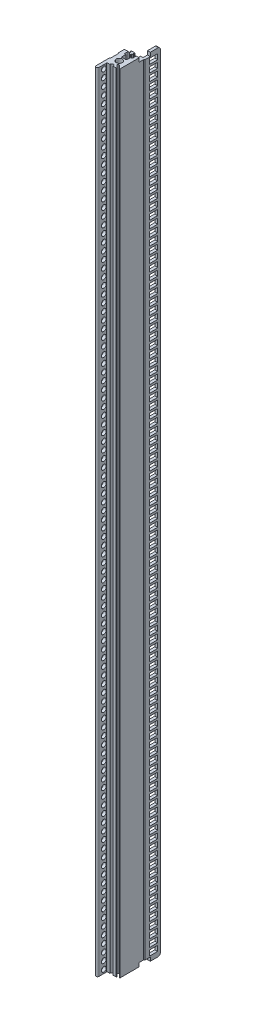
SolidWorks part; units mm, degrees
ref_plane "前视基准面" through (0, 0, 0) normal (0, 0, 1) x (1, 0, 0)
ref_plane "上视基准面" through (0, 0, 0) normal (0, 1, 0) x (1, 0, 0)
ref_plane "右视基准面" through (0, 0, 0) normal (1, 0, 0) x (0, 0, -1)
sketch "草图1" plane through (0, 0, 0) normal (0, 1, 0) x (1, 0, 0)
  line L0 (-4.2, 11.9) -> (-3.9, 11.9)
  line L1 (-4.4, 12.2) -> (-4.4, 12.1)
  line L2 (-4.0328, 12.4) -> (-4.2, 12.4)
  line L3 (-3.85, 12.5) -> (-3.8914, 12.4586)
  line L4 (-2.05, 12.5) -> (-3.85, 12.5)
  line L5 (-2.0086, 12.4586) -> (-2.05, 12.5)
  line L6 (-1.7, 12.4) -> (-1.8672, 12.4)
  line L7 (-1.5, 12.1) -> (-1.5, 12.2)
  line L8 (-1.8, 11.9) -> (-1.7, 11.9)
  line L9 (-2, 11.4828) -> (-2, 11.7)
  line L10 (-1.3586, 10.7586) -> (-1.9414, 11.3414)
  line L11 (-1.3, 10.55) -> (-1.3, 10.6172)
  line L12 (-3.7, 11.7) -> (-3.7, 9.95)
  line L13 (-5, -10.75) -> (-5, -1.6)
  line L14 (-3, -10.75) -> (-3, -5.75)
  line L15 (-2.5, -5.25) -> (-1.15, -5.25)
  line L16 (1.6887, -3.3855) -> (3.2118, -4.9086)
  line L17 (2.5373, -2.537) -> (4.6586, -4.6583)
  line L18 (5, 15) -> (5, 5.1793)
  line L19 (3.6, 15) -> (5, 15)
  line L20 (3.6, 12.5) -> (3.6, 15)
  line L21 (1.95, 12.5) -> (3.6, 12.5)
  line L22 (1.95, 10.55) -> (1.95, 12.5)
  line L23 (2.85, 10.55) -> (1.95, 10.55)
  line L24 (2.85, 9.35) -> (2.85, 10.55)
  line L25 (1.95, 9.35) -> (2.85, 9.35)
  line L26 (1.95, 8.35) -> (1.95, 9.35)
  line L27 (2.85, 8.35) -> (1.95, 8.35)
  line L28 (2.85, 6.05) -> (2.85, 8.35)
  line L29 (1.95, 6.05) -> (2.85, 6.05)
  line L30 (1.95, 3.8856) -> (1.95, 6.05)
  line L31 (-1.45, 6.05) -> (-1.45, 2.9458)
  line L32 (-2.35, 6.05) -> (-1.45, 6.05)
  line L33 (-2.35, 8.35) -> (-2.35, 6.05)
  line L34 (-1.45, 8.35) -> (-2.35, 8.35)
  line L35 (-1.45, 9.35) -> (-1.45, 8.35)
  line L36 (-2.35, 9.35) -> (-1.45, 9.35)
  line L37 (-2.35, 10.55) -> (-2.35, 9.35)
  line L38 (-1.3, 10.55) -> (-2.35, 10.55)
  line L39 (-4.45, 7.7) -> (-4.7, 7.7) construction
  line L40 (-5, 7.4) -> (-4.7, 7.7) construction
  line L41 (-5, 4.4) -> (-5, 7.4)
  line L42 (-4.5499, 3.8998) -> (-5, 4.4)
  line L43 (-4.45, 8.5) -> (-4.45, 9.55)
  line L44 (-3.9, 9.75) -> (-4.25, 9.75)
  line L45 (-4.5499, 3.8998) -> (-4.5501, -1.1002)
  line L46 (-5, -1.6) -> (-4.5501, -1.1002)
  line L47 (4.9414, -1.9395) -> (4.6464, -1.6446) construction
  line L48 (5, -2.081) -> (5, -4.5169)
  line L49 (0, 0) -> (0, -5) construction
  line L50 (4.5, -1.291) -> (4.5, 4.3894) construction
  line L51 (-1.05, -5) -> (-1.05, -5.15)
  line L52 (1.05, -5) -> (1.05, -5.15)
  line L53 (1.15, -5.25) -> (3.0703, -5.25)
  line L54 (2.5373, -2.537) -> (1.6887, -3.3855) construction
  line L55 (5, 5.1793) -> (5, -2.081)
  line L56 (-4.45, 8.5) -> (-4.7, 8.5)
  line L57 (-4.7, 8.5) -> (-5, 8.2)
  line L58 (4.9414, 5.0379) -> (4.6464, 4.743) construction
  line L59 (-5, 8.2) -> (-5, 7.4)
  circle A0 centre (0, 0) radius 1.6
  arc A1 (-4.4, 12.1) -> (-4.2, 11.9) centre (-4.2, 12.1) ccw
  arc A2 (-4.2, 12.4) -> (-4.4, 12.2) centre (-4.2, 12.2) ccw
  arc A3 (-4.0328, 12.4) -> (-3.8914, 12.4586) centre (-4.0328, 12.6) ccw
  arc A4 (-2.0086, 12.4586) -> (-1.8672, 12.4) centre (-1.8672, 12.6) ccw
  arc A5 (-1.5, 12.2) -> (-1.7, 12.4) centre (-1.7, 12.2) ccw
  arc A6 (-1.7, 11.9) -> (-1.5, 12.1) centre (-1.7, 12.1) ccw
  arc A7 (-1.8, 11.9) -> (-2, 11.7) centre (-1.8, 11.7) ccw
  arc A8 (-2, 11.4828) -> (-1.9414, 11.3414) centre (-1.8, 11.4828) ccw
  arc A9 (-1.3, 10.6172) -> (-1.3586, 10.7586) centre (-1.5, 10.6172) ccw
  arc A10 (-5, -10.75) -> (-3, -10.75) centre (-4, -10.75) ccw
  arc A11 (3.0703, -5.25) -> (3.2118, -4.9086) centre (3.0703, -5.05) ccw
  arc A12 (-4.25, 9.75) -> (-4.45, 9.55) centre (-4.25, 9.55) ccw
  arc A13 (-3.9, 9.75) -> (-3.7, 9.95) centre (-3.9, 9.95) ccw
  arc A14 (5, -2.081) -> (4.9414, -1.9395) centre (4.8, -2.081) ccw construction
  arc A15 (4.9414, 5.0379) -> (5, 5.1793) centre (4.8, 5.1793) ccw construction
  arc A16 (4.6586, -4.6583) -> (5, -4.5169) centre (4.8, -4.5169) ccw
  arc A17 (2.5373, -2.537) -> (1.6887, -3.3855) centre (2.113, -2.9613) ccw
  arc A18 (0.7125, 2.9142) -> (-1.1719, 2.7616) centre (0, 0) ccw
  arc A19 (-1.45, 2.9458) -> (-1.1719, 2.7616) centre (-1.25, 2.9458) ccw
  arc A20 (0.7125, 2.9142) -> (1.95, 3.8856) centre (0.95, 3.8856) ccw
  arc A21 (-3.7, 11.7) -> (-3.9, 11.9) centre (-3.9, 11.7) ccw
  arc A22 (4.6464, -1.6446) -> (4.5, -1.291) centre (5, -1.291) cw construction
  arc A23 (4.5, 4.3894) -> (4.6464, 4.743) centre (5, 4.3894) cw construction
  arc A24 (1.05, -5) -> (-1.05, -5) centre (0, -5) ccw
  arc A25 (1.15, -5.25) -> (1.05, -5.15) centre (1.15, -5.15) cw
  arc A26 (-1.05, -5.15) -> (-1.15, -5.25) centre (-1.15, -5.15) cw
  arc A29 (-3, -5.75) -> (-2.5, -5.25) centre (-2.5, -5.75) cw
  point P104 (1.05, -5.25)
  dimension "D1" = 3.2
  dimension "D2" = 2.1
  dimension "D3" = 5.2
  dimension "D4" = 45
  dimension "D5" = 1.2
  dimension "D7" = 0.6
  dimension "D8" = 0.2
  dimension "D10" = 5
  dimension "D11" = 0.1
  dimension "D12" = 0.5
  dimension "D13" = 0.5
  dimension "D6" = 3
  dimension "D9" = 2.1225
  dimension "D14" = 0.25
  dimension "D15" = 0.8
extrude "凸台-拉伸1" add sketch "草图1" along normal mid plane 533.4
sketch "草图8" plane through (0, -266.7, 0) normal (0, -1, 0) x (-1, 0, 0)
  line L0 (2.35, 8.35) -> (1.45, 8.35) construction
  line L1 (-2.95, 5.85) -> (2.45, 5.85)
  line L2 (-2.95, 5.85) -> (-2.95, 8.35)
  line L3 (-2.95, 8.35) -> (2.45, 8.35)
  line L4 (2.45, 5.85) -> (2.45, 8.35)
  line L5 (-2.85, 8.35) -> (-2.85, 6.05) construction
  line L6 (2.35, 6.05) -> (2.35, 8.35) construction
  line L7 (1.45, 6.05) -> (2.35, 6.05) construction
  line L8 (-2.85, 9.35) -> (-1.95, 9.35) construction
  line L9 (-2.95, 9.35) -> (2.45, 9.35)
  line L10 (-2.95, 9.35) -> (-2.95, 10.55)
  line L11 (-2.95, 10.55) -> (2.45, 10.55)
  line L12 (2.45, 9.35) -> (2.45, 10.55)
  line L13 (2.35, 10.55) -> (1.3, 10.55) construction
  line L14 (-2.85, 10.55) -> (-2.85, 9.35) construction
  line L15 (2.35, 9.35) -> (2.35, 10.55) construction
  dimension "D1" = 0.1
  dimension "D2" = 0.1
  dimension "D3" = 0.2
  dimension "D4" = 0.1
  dimension "D5" = 0.1
extrude "切除-拉伸6" cut sketch "草图8" against normal through all
fillet "圆角2" radius 0.2 8 edges at (-2.45, 0, -8.35) (-2.45, 0, -5.85) (2.95, 0, -8.35) (2.95, 0, -5.85) (-2.45, 0, -10.55) (-2.45, 0, -9.35) (2.95, 0, -10.55) (2.95, 0, -9.35)
sketch "草图6" plane through (0, 266.7, 0) normal (0, 1, 0) x (1, 0, 0)
  line L0 (3.6, 12.5) -> (3.6, 22.5)
  line L1 (3.6, 22.5) -> (5.5, 22.5)
  line L2 (5.5, 22.5) -> (5.5, 12)
  line L3 (5.5, 12) -> (5, 11.5)
  line L4 (3.6, 12.5) -> (5, 11.5)
  line L5 (5, -4.5169) -> (5, 15) construction
  line L6 (-5, 8.2) -> (-5, 4.4) construction
  dimension "D4" = 11
  dimension "D1" = 10.5
  dimension "D2" = 10
  dimension "D3" = 45
extrude "凸台-拉伸2" add sketch "草图6" against normal up to surface (533.4 mm away)
sketch "草图2" plane through (0, 266.7, 0) normal (0, 1, 0) x (1, 0, 0)
  circle A0 centre (0, 0) radius 2.1
  dimension "D1" = 4.2
extrude "切除-拉伸1" cut sketch "草图2" against normal blind 10
sketch "草图3" plane through (0, -266.7, 0) normal (0, -1, 0) x (1, 0, 0)
  circle A0 centre (0, 0) radius 2.1
  dimension "D1" = 4.2
extrude "切除-拉伸2" cut sketch "草图3" against normal blind 10
sketch "草图4" plane through (-5, 0, 0) normal (-1, 0, 0) x (0, 0, 1)
  line L0 (1.6, -266.7) -> (10.75, -266.7) construction
  line L1 (11.75, -266.7) -> (11.75, 266.7) construction
  circle A0 centre (7.5, -264.16) radius 1.65
  circle A1 centre (7.5, -259.08) radius 1.65
  circle A2 centre (7.5, -254) radius 1.65
  circle A3 centre (7.5, -248.92) radius 1.65
  circle A4 centre (7.5, -243.84) radius 1.65
  circle A5 centre (7.5, -238.76) radius 1.65
  circle A6 centre (7.5, -233.68) radius 1.65
  circle A7 centre (7.5, -228.6) radius 1.65
  circle A8 centre (7.5, -223.52) radius 1.65
  circle A9 centre (7.5, -218.44) radius 1.65
  circle A10 centre (7.5, -213.36) radius 1.65
  circle A11 centre (7.5, -208.28) radius 1.65
  circle A12 centre (7.5, -203.2) radius 1.65
  circle A13 centre (7.5, -198.12) radius 1.65
  circle A14 centre (7.5, -193.04) radius 1.65
  circle A15 centre (7.5, -187.96) radius 1.65
  circle A16 centre (7.5, -182.88) radius 1.65
  circle A17 centre (7.5, -177.8) radius 1.65
  circle A18 centre (7.5, -172.72) radius 1.65
  circle A19 centre (7.5, -167.64) radius 1.65
  circle A20 centre (7.5, -162.56) radius 1.65
  circle A21 centre (7.5, -157.48) radius 1.65
  circle A22 centre (7.5, -152.4) radius 1.65
  circle A23 centre (7.5, -147.32) radius 1.65
  circle A24 centre (7.5, -142.24) radius 1.65
  circle A25 centre (7.5, -137.16) radius 1.65
  circle A26 centre (7.5, -132.08) radius 1.65
  circle A27 centre (7.5, -127) radius 1.65
  circle A28 centre (7.5, -121.92) radius 1.65
  circle A29 centre (7.5, -116.84) radius 1.65
  circle A30 centre (7.5, -111.76) radius 1.65
  circle A31 centre (7.5, -106.68) radius 1.65
  circle A32 centre (7.5, -101.6) radius 1.65
  circle A33 centre (7.5, -96.52) radius 1.65
  circle A34 centre (7.5, -91.44) radius 1.65
  circle A35 centre (7.5, -86.36) radius 1.65
  circle A36 centre (7.5, -81.28) radius 1.65
  circle A37 centre (7.5, -76.2) radius 1.65
  circle A38 centre (7.5, -71.12) radius 1.65
  circle A39 centre (7.5, -66.04) radius 1.65
  circle A40 centre (7.5, -60.96) radius 1.65
  circle A41 centre (7.5, -55.88) radius 1.65
  circle A42 centre (7.5, -50.8) radius 1.65
  circle A43 centre (7.5, -45.72) radius 1.65
  circle A44 centre (7.5, -40.64) radius 1.65
  circle A45 centre (7.5, -35.56) radius 1.65
  circle A46 centre (7.5, -30.48) radius 1.65
  circle A47 centre (7.5, -25.4) radius 1.65
  circle A48 centre (7.5, -20.32) radius 1.65
  circle A49 centre (7.5, -15.24) radius 1.65
  circle A50 centre (7.5, -10.16) radius 1.65
  circle A51 centre (7.5, -5.08) radius 1.65
  circle A52 centre (7.5, 0) radius 1.65
  circle A53 centre (7.5, 5.08) radius 1.65
  circle A54 centre (7.5, 10.16) radius 1.65
  circle A55 centre (7.5, 15.24) radius 1.65
  circle A56 centre (7.5, 20.32) radius 1.65
  circle A57 centre (7.5, 25.4) radius 1.65
  circle A58 centre (7.5, 30.48) radius 1.65
  circle A59 centre (7.5, 35.56) radius 1.65
  circle A60 centre (7.5, 40.64) radius 1.65
  circle A61 centre (7.5, 45.72) radius 1.65
  circle A62 centre (7.5, 50.8) radius 1.65
  circle A63 centre (7.5, 55.88) radius 1.65
  circle A64 centre (7.5, 60.96) radius 1.65
  circle A65 centre (7.5, 66.04) radius 1.65
  circle A66 centre (7.5, 71.12) radius 1.65
  circle A67 centre (7.5, 76.2) radius 1.65
  circle A68 centre (7.5, 81.28) radius 1.65
  circle A69 centre (7.5, 86.36) radius 1.65
  circle A70 centre (7.5, 91.44) radius 1.65
  circle A71 centre (7.5, 96.52) radius 1.65
  circle A72 centre (7.5, 101.6) radius 1.65
  circle A73 centre (7.5, 106.68) radius 1.65
  circle A74 centre (7.5, 111.76) radius 1.65
  circle A75 centre (7.5, 116.84) radius 1.65
  circle A76 centre (7.5, 121.92) radius 1.65
  circle A77 centre (7.5, 127) radius 1.65
  circle A78 centre (7.5, 132.08) radius 1.65
  circle A79 centre (7.5, 137.16) radius 1.65
  circle A80 centre (7.5, 142.24) radius 1.65
  circle A81 centre (7.5, 147.32) radius 1.65
  circle A82 centre (7.5, 152.4) radius 1.65
  circle A83 centre (7.5, 157.48) radius 1.65
  circle A84 centre (7.5, 162.56) radius 1.65
  circle A85 centre (7.5, 182.88) radius 1.65
  circle A86 centre (7.5, 177.8) radius 1.65
  circle A87 centre (7.5, 193.04) radius 1.65
  circle A88 centre (7.5, 243.84) radius 1.65
  circle A89 centre (7.5, 223.52) radius 1.65
  circle A90 centre (7.5, 172.72) radius 1.65
  circle A91 centre (7.5, 203.2) radius 1.65
  circle A92 centre (7.5, 187.96) radius 1.65
  circle A93 centre (7.5, 167.64) radius 1.65
  circle A94 centre (7.5, 218.44) radius 1.65
  circle A95 centre (7.5, 248.92) radius 1.65
  circle A96 centre (7.5, 254) radius 1.65
  circle A97 centre (7.5, 208.28) radius 1.65
  circle A98 centre (7.5, 213.36) radius 1.65
  circle A99 centre (7.5, 198.12) radius 1.65
  circle A100 centre (7.5, 233.68) radius 1.65
  circle A101 centre (7.5, 238.76) radius 1.65
  circle A102 centre (7.5, 228.6) radius 1.65
  circle A108 centre (7.5, 264.16) radius 1.65
  circle A111 centre (7.5, 259.08) radius 1.65
  dimension "D1" = 2.54
  dimension "D2" = 4.25
  dimension "D3" = 3.3
  dimension "D5" = 5.08
  dimension "D4" = 85
extrude "切除-拉伸3" cut sketch "草图4" against normal blind 12
sketch "草图5" plane through (5.5, 0, 0) normal (1, 0, 0) x (0, 0, -1)
  line L0 (-19.1753, 0) -> (41.1348, 0) construction
  line L1 (15.5, 266.7) -> (8.5, 266.7)
  line L2 (15.5, 266.7) -> (15.5, 264.16)
  line L3 (15.5, 264.16) -> (8.5, 264.16)
  line L4 (8.5, 266.7) -> (8.5, 264.16)
  line L6 (8.5, -266.7) -> (8.5, -264.16)
  line L7 (15.5, -264.16) -> (8.5, -264.16)
  line L8 (15.5, -266.7) -> (15.5, -264.16)
  line L9 (15.5, -266.7) -> (8.5, -266.7)
  line L10 (12, 266.7) -> (22.5, 266.7) construction
  line L11 (22.5, -266.7) -> (22.5, 266.7) construction
  dimension "D1" = 7
  dimension "D2" = 2.54
  dimension "D3" = 7
extrude "切除-拉伸4" cut sketch "草图5" against normal through all
sketch "草图7" plane through (5.5, 0, 0) normal (1, 0, 0) x (0, 0, -1)
  line L0 (22.5, -266.7) -> (22.5, 266.7) construction
  line L1 (15, -263.42) -> (20.5, -263.42)
  line L2 (15, -263.42) -> (15, -259.82)
  line L3 (15, -259.82) -> (20.5, -259.82)
  line L4 (20.5, -263.42) -> (20.5, -259.82)
  line L5 (22.5, -266.7) -> (15.5, -266.7) construction
  line L6 (15, -258.34) -> (20.5, -258.34)
  line L7 (15, -258.34) -> (15, -254.74)
  line L8 (15, -254.74) -> (20.5, -254.74)
  line L9 (20.5, -258.34) -> (20.5, -254.74)
  line L10 (15, -253.26) -> (20.5, -253.26)
  line L11 (15, -253.26) -> (15, -249.66)
  line L12 (15, -249.66) -> (20.5, -249.66)
  line L13 (20.5, -253.26) -> (20.5, -249.66)
  line L14 (15, -248.18) -> (20.5, -248.18)
  line L15 (15, -248.18) -> (15, -244.58)
  line L16 (15, -244.58) -> (20.5, -244.58)
  line L17 (20.5, -248.18) -> (20.5, -244.58)
  line L18 (15, -243.1) -> (20.5, -243.1)
  line L19 (15, -243.1) -> (15, -239.5)
  line L20 (15, -239.5) -> (20.5, -239.5)
  line L21 (20.5, -243.1) -> (20.5, -239.5)
  line L22 (15, -238.02) -> (20.5, -238.02)
  line L23 (15, -238.02) -> (15, -234.42)
  line L24 (15, -234.42) -> (20.5, -234.42)
  line L25 (20.5, -238.02) -> (20.5, -234.42)
  line L26 (15, -232.94) -> (20.5, -232.94)
  line L27 (15, -232.94) -> (15, -229.34)
  line L28 (15, -229.34) -> (20.5, -229.34)
  line L29 (20.5, -232.94) -> (20.5, -229.34)
  line L30 (15, -227.86) -> (20.5, -227.86)
  line L31 (15, -227.86) -> (15, -224.26)
  line L32 (15, -224.26) -> (20.5, -224.26)
  line L33 (20.5, -227.86) -> (20.5, -224.26)
  line L34 (15, -222.78) -> (20.5, -222.78)
  line L35 (15, -222.78) -> (15, -219.18)
  line L36 (15, -219.18) -> (20.5, -219.18)
  line L37 (20.5, -222.78) -> (20.5, -219.18)
  line L38 (15, -217.7) -> (20.5, -217.7)
  line L39 (15, -217.7) -> (15, -214.1)
  line L40 (15, -214.1) -> (20.5, -214.1)
  line L41 (20.5, -217.7) -> (20.5, -214.1)
  line L42 (15, -212.62) -> (20.5, -212.62)
  line L43 (15, -212.62) -> (15, -209.02)
  line L44 (15, -209.02) -> (20.5, -209.02)
  line L45 (20.5, -212.62) -> (20.5, -209.02)
  line L46 (15, -207.54) -> (20.5, -207.54)
  line L47 (15, -207.54) -> (15, -203.94)
  line L48 (15, -203.94) -> (20.5, -203.94)
  line L49 (20.5, -207.54) -> (20.5, -203.94)
  line L50 (15, -202.46) -> (20.5, -202.46)
  line L51 (15, -202.46) -> (15, -198.86)
  line L52 (15, -198.86) -> (20.5, -198.86)
  line L53 (20.5, -202.46) -> (20.5, -198.86)
  line L54 (15, -197.38) -> (20.5, -197.38)
  line L55 (15, -197.38) -> (15, -193.78)
  line L56 (15, -193.78) -> (20.5, -193.78)
  line L57 (20.5, -197.38) -> (20.5, -193.78)
  line L58 (15, -192.3) -> (20.5, -192.3)
  line L59 (15, -192.3) -> (15, -188.7)
  line L60 (15, -188.7) -> (20.5, -188.7)
  line L61 (20.5, -192.3) -> (20.5, -188.7)
  line L62 (15, -187.22) -> (20.5, -187.22)
  line L63 (15, -187.22) -> (15, -183.62)
  line L64 (15, -183.62) -> (20.5, -183.62)
  line L65 (20.5, -187.22) -> (20.5, -183.62)
  line L66 (15, -182.14) -> (20.5, -182.14)
  line L67 (15, -182.14) -> (15, -178.54)
  line L68 (15, -178.54) -> (20.5, -178.54)
  line L69 (20.5, -182.14) -> (20.5, -178.54)
  line L70 (15, -177.06) -> (20.5, -177.06)
  line L71 (15, -177.06) -> (15, -173.46)
  line L72 (15, -173.46) -> (20.5, -173.46)
  line L73 (20.5, -177.06) -> (20.5, -173.46)
  line L74 (15, -171.98) -> (20.5, -171.98)
  line L75 (15, -171.98) -> (15, -168.38)
  line L76 (15, -168.38) -> (20.5, -168.38)
  line L77 (20.5, -171.98) -> (20.5, -168.38)
  line L78 (15, -166.9) -> (20.5, -166.9)
  line L79 (15, -166.9) -> (15, -163.3)
  line L80 (15, -163.3) -> (20.5, -163.3)
  line L81 (20.5, -166.9) -> (20.5, -163.3)
  line L82 (15, -161.82) -> (20.5, -161.82)
  line L83 (15, -161.82) -> (15, -158.22)
  line L84 (15, -158.22) -> (20.5, -158.22)
  line L85 (20.5, -161.82) -> (20.5, -158.22)
  line L86 (15, -156.74) -> (20.5, -156.74)
  line L87 (15, -156.74) -> (15, -153.14)
  line L88 (15, -153.14) -> (20.5, -153.14)
  line L89 (20.5, -156.74) -> (20.5, -153.14)
  line L90 (15, -151.66) -> (20.5, -151.66)
  line L91 (15, -151.66) -> (15, -148.06)
  line L92 (15, -148.06) -> (20.5, -148.06)
  line L93 (20.5, -151.66) -> (20.5, -148.06)
  line L94 (15, -146.58) -> (20.5, -146.58)
  line L95 (15, -146.58) -> (15, -142.98)
  line L96 (15, -142.98) -> (20.5, -142.98)
  line L97 (20.5, -146.58) -> (20.5, -142.98)
  line L98 (15, -141.5) -> (20.5, -141.5)
  line L99 (15, -141.5) -> (15, -137.9)
  line L100 (15, -137.9) -> (20.5, -137.9)
  line L101 (20.5, -141.5) -> (20.5, -137.9)
  line L102 (15, -136.42) -> (20.5, -136.42)
  line L103 (15, -136.42) -> (15, -132.82)
  line L104 (15, -132.82) -> (20.5, -132.82)
  line L105 (20.5, -136.42) -> (20.5, -132.82)
  line L106 (15, -131.34) -> (20.5, -131.34)
  line L107 (15, -131.34) -> (15, -127.74)
  line L108 (15, -127.74) -> (20.5, -127.74)
  line L109 (20.5, -131.34) -> (20.5, -127.74)
  line L110 (15, -126.26) -> (20.5, -126.26)
  line L111 (15, -126.26) -> (15, -122.66)
  line L112 (15, -122.66) -> (20.5, -122.66)
  line L113 (20.5, -126.26) -> (20.5, -122.66)
  line L114 (15, -121.18) -> (20.5, -121.18)
  line L115 (15, -121.18) -> (15, -117.58)
  line L116 (15, -117.58) -> (20.5, -117.58)
  line L117 (20.5, -121.18) -> (20.5, -117.58)
  line L118 (15, -116.1) -> (20.5, -116.1)
  line L119 (15, -116.1) -> (15, -112.5)
  line L120 (15, -112.5) -> (20.5, -112.5)
  line L121 (20.5, -116.1) -> (20.5, -112.5)
  line L122 (15, -111.02) -> (20.5, -111.02)
  line L123 (15, -111.02) -> (15, -107.42)
  line L124 (15, -107.42) -> (20.5, -107.42)
  line L125 (20.5, -111.02) -> (20.5, -107.42)
  line L126 (15, -105.94) -> (20.5, -105.94)
  line L127 (15, -105.94) -> (15, -102.34)
  line L128 (15, -102.34) -> (20.5, -102.34)
  line L129 (20.5, -105.94) -> (20.5, -102.34)
  line L130 (15, -100.86) -> (20.5, -100.86)
  line L131 (15, -100.86) -> (15, -97.26)
  line L132 (15, -97.26) -> (20.5, -97.26)
  line L133 (20.5, -100.86) -> (20.5, -97.26)
  line L134 (15, -95.78) -> (20.5, -95.78)
  line L135 (15, -95.78) -> (15, -92.18)
  line L136 (15, -92.18) -> (20.5, -92.18)
  line L137 (20.5, -95.78) -> (20.5, -92.18)
  line L138 (15, -90.7) -> (20.5, -90.7)
  line L139 (15, -90.7) -> (15, -87.1)
  line L140 (15, -87.1) -> (20.5, -87.1)
  line L141 (20.5, -90.7) -> (20.5, -87.1)
  line L142 (15, -85.62) -> (20.5, -85.62)
  line L143 (15, -85.62) -> (15, -82.02)
  line L144 (15, -82.02) -> (20.5, -82.02)
  line L145 (20.5, -85.62) -> (20.5, -82.02)
  line L146 (15, -80.54) -> (20.5, -80.54)
  line L147 (15, -80.54) -> (15, -76.94)
  line L148 (15, -76.94) -> (20.5, -76.94)
  line L149 (20.5, -80.54) -> (20.5, -76.94)
  line L150 (15, -75.46) -> (20.5, -75.46)
  line L151 (15, -75.46) -> (15, -71.86)
  line L152 (15, -71.86) -> (20.5, -71.86)
  line L153 (20.5, -75.46) -> (20.5, -71.86)
  line L154 (15, -70.38) -> (20.5, -70.38)
  line L155 (15, -70.38) -> (15, -66.78)
  line L156 (15, -66.78) -> (20.5, -66.78)
  line L157 (20.5, -70.38) -> (20.5, -66.78)
  line L158 (15, -65.3) -> (20.5, -65.3)
  line L159 (15, -65.3) -> (15, -61.7)
  line L160 (15, -61.7) -> (20.5, -61.7)
  line L161 (20.5, -65.3) -> (20.5, -61.7)
  line L162 (15, -60.22) -> (20.5, -60.22)
  line L163 (15, -60.22) -> (15, -56.62)
  line L164 (15, -56.62) -> (20.5, -56.62)
  line L165 (20.5, -60.22) -> (20.5, -56.62)
  line L166 (15, -55.14) -> (20.5, -55.14)
  line L167 (15, -55.14) -> (15, -51.54)
  line L168 (15, -51.54) -> (20.5, -51.54)
  line L169 (20.5, -55.14) -> (20.5, -51.54)
  line L170 (15, -50.06) -> (20.5, -50.06)
  line L171 (15, -50.06) -> (15, -46.46)
  line L172 (15, -46.46) -> (20.5, -46.46)
  line L173 (20.5, -50.06) -> (20.5, -46.46)
  line L174 (15, -44.98) -> (20.5, -44.98)
  line L175 (15, -44.98) -> (15, -41.38)
  line L176 (15, -41.38) -> (20.5, -41.38)
  line L177 (20.5, -44.98) -> (20.5, -41.38)
  line L178 (15, -39.9) -> (20.5, -39.9)
  line L179 (15, -39.9) -> (15, -36.3)
  line L180 (15, -36.3) -> (20.5, -36.3)
  line L181 (20.5, -39.9) -> (20.5, -36.3)
  line L182 (15, -34.82) -> (20.5, -34.82)
  line L183 (15, -34.82) -> (15, -31.22)
  line L184 (15, -31.22) -> (20.5, -31.22)
  line L185 (20.5, -34.82) -> (20.5, -31.22)
  line L186 (15, -29.74) -> (20.5, -29.74)
  line L187 (15, -29.74) -> (15, -26.14)
  line L188 (15, -26.14) -> (20.5, -26.14)
  line L189 (20.5, -29.74) -> (20.5, -26.14)
  line L190 (15, -24.66) -> (20.5, -24.66)
  line L191 (15, -24.66) -> (15, -21.06)
  line L192 (15, -21.06) -> (20.5, -21.06)
  line L193 (20.5, -24.66) -> (20.5, -21.06)
  line L194 (15, -19.58) -> (20.5, -19.58)
  line L195 (15, -19.58) -> (15, -15.98)
  line L196 (15, -15.98) -> (20.5, -15.98)
  line L197 (20.5, -19.58) -> (20.5, -15.98)
  line L198 (15, -14.5) -> (20.5, -14.5)
  line L199 (15, -14.5) -> (15, -10.9)
  line L200 (15, -10.9) -> (20.5, -10.9)
  line L201 (20.5, -14.5) -> (20.5, -10.9)
  line L202 (15, -9.42) -> (20.5, -9.42)
  line L203 (15, -9.42) -> (15, -5.82)
  line L204 (15, -5.82) -> (20.5, -5.82)
  line L205 (20.5, -9.42) -> (20.5, -5.82)
  line L206 (15, -4.34) -> (20.5, -4.34)
  line L207 (15, -4.34) -> (15, -0.74)
  line L208 (15, -0.74) -> (20.5, -0.74)
  line L209 (20.5, -4.34) -> (20.5, -0.74)
  line L210 (15, 0.74) -> (20.5, 0.74)
  line L211 (15, 0.74) -> (15, 4.34)
  line L212 (15, 4.34) -> (20.5, 4.34)
  line L213 (20.5, 0.74) -> (20.5, 4.34)
  line L214 (15, 5.82) -> (20.5, 5.82)
  line L215 (15, 5.82) -> (15, 9.42)
  line L216 (15, 9.42) -> (20.5, 9.42)
  line L217 (20.5, 5.82) -> (20.5, 9.42)
  line L218 (15, 10.9) -> (20.5, 10.9)
  line L219 (15, 10.9) -> (15, 14.5)
  line L220 (15, 14.5) -> (20.5, 14.5)
  line L221 (20.5, 10.9) -> (20.5, 14.5)
  line L222 (15, 15.98) -> (20.5, 15.98)
  line L223 (15, 15.98) -> (15, 19.58)
  line L224 (15, 19.58) -> (20.5, 19.58)
  line L225 (20.5, 15.98) -> (20.5, 19.58)
  line L226 (15, 21.06) -> (20.5, 21.06)
  line L227 (15, 21.06) -> (15, 24.66)
  line L228 (15, 24.66) -> (20.5, 24.66)
  line L229 (20.5, 21.06) -> (20.5, 24.66)
  line L230 (15, 26.14) -> (20.5, 26.14)
  line L231 (15, 26.14) -> (15, 29.74)
  line L232 (15, 29.74) -> (20.5, 29.74)
  line L233 (20.5, 26.14) -> (20.5, 29.74)
  line L234 (15, 31.22) -> (20.5, 31.22)
  line L235 (15, 31.22) -> (15, 34.82)
  line L236 (15, 34.82) -> (20.5, 34.82)
  line L237 (20.5, 31.22) -> (20.5, 34.82)
  line L238 (15, 36.3) -> (20.5, 36.3)
  line L239 (15, 36.3) -> (15, 39.9)
  line L240 (15, 39.9) -> (20.5, 39.9)
  line L241 (20.5, 36.3) -> (20.5, 39.9)
  line L242 (15, 41.38) -> (20.5, 41.38)
  line L243 (15, 41.38) -> (15, 44.98)
  line L244 (15, 44.98) -> (20.5, 44.98)
  line L245 (20.5, 41.38) -> (20.5, 44.98)
  line L246 (15, 46.46) -> (20.5, 46.46)
  line L247 (15, 46.46) -> (15, 50.06)
  line L248 (15, 50.06) -> (20.5, 50.06)
  line L249 (20.5, 46.46) -> (20.5, 50.06)
  line L250 (15, 51.54) -> (20.5, 51.54)
  line L251 (15, 51.54) -> (15, 55.14)
  line L252 (15, 55.14) -> (20.5, 55.14)
  line L253 (20.5, 51.54) -> (20.5, 55.14)
  line L254 (15, 56.62) -> (20.5, 56.62)
  line L255 (15, 56.62) -> (15, 60.22)
  line L256 (15, 60.22) -> (20.5, 60.22)
  line L257 (20.5, 56.62) -> (20.5, 60.22)
  line L258 (15, 61.7) -> (20.5, 61.7)
  line L259 (15, 61.7) -> (15, 65.3)
  line L260 (15, 65.3) -> (20.5, 65.3)
  line L261 (20.5, 61.7) -> (20.5, 65.3)
  line L262 (15, 66.78) -> (20.5, 66.78)
  line L263 (15, 66.78) -> (15, 70.38)
  line L264 (15, 70.38) -> (20.5, 70.38)
  line L265 (20.5, 66.78) -> (20.5, 70.38)
  line L266 (15, 71.86) -> (20.5, 71.86)
  line L267 (15, 71.86) -> (15, 75.46)
  line L268 (15, 75.46) -> (20.5, 75.46)
  line L269 (20.5, 71.86) -> (20.5, 75.46)
  line L270 (15, 76.94) -> (20.5, 76.94)
  line L271 (15, 76.94) -> (15, 80.54)
  line L272 (15, 80.54) -> (20.5, 80.54)
  line L273 (20.5, 76.94) -> (20.5, 80.54)
  line L274 (15, 82.02) -> (20.5, 82.02)
  line L275 (15, 82.02) -> (15, 85.62)
  line L276 (15, 85.62) -> (20.5, 85.62)
  line L277 (20.5, 82.02) -> (20.5, 85.62)
  line L278 (15, 87.1) -> (20.5, 87.1)
  line L279 (15, 87.1) -> (15, 90.7)
  line L280 (15, 90.7) -> (20.5, 90.7)
  line L281 (20.5, 87.1) -> (20.5, 90.7)
  line L282 (15, 92.18) -> (20.5, 92.18)
  line L283 (15, 92.18) -> (15, 95.78)
  line L284 (15, 95.78) -> (20.5, 95.78)
  line L285 (20.5, 92.18) -> (20.5, 95.78)
  line L286 (15, 97.26) -> (20.5, 97.26)
  line L287 (15, 97.26) -> (15, 100.86)
  line L288 (15, 100.86) -> (20.5, 100.86)
  line L289 (20.5, 97.26) -> (20.5, 100.86)
  line L290 (15, 102.34) -> (20.5, 102.34)
  line L291 (15, 102.34) -> (15, 105.94)
  line L292 (15, 105.94) -> (20.5, 105.94)
  line L293 (20.5, 102.34) -> (20.5, 105.94)
  line L294 (15, 107.42) -> (20.5, 107.42)
  line L295 (15, 107.42) -> (15, 111.02)
  line L296 (15, 111.02) -> (20.5, 111.02)
  line L297 (20.5, 107.42) -> (20.5, 111.02)
  line L298 (15, 112.5) -> (20.5, 112.5)
  line L299 (15, 112.5) -> (15, 116.1)
  line L300 (15, 116.1) -> (20.5, 116.1)
  line L301 (20.5, 112.5) -> (20.5, 116.1)
  line L302 (15, 117.58) -> (20.5, 117.58)
  line L303 (15, 117.58) -> (15, 121.18)
  line L304 (15, 121.18) -> (20.5, 121.18)
  line L305 (20.5, 117.58) -> (20.5, 121.18)
  line L306 (15, 122.66) -> (20.5, 122.66)
  line L307 (15, 122.66) -> (15, 126.26)
  line L308 (15, 126.26) -> (20.5, 126.26)
  line L309 (20.5, 122.66) -> (20.5, 126.26)
  line L310 (15, 127.74) -> (20.5, 127.74)
  line L311 (15, 127.74) -> (15, 131.34)
  line L312 (15, 131.34) -> (20.5, 131.34)
  line L313 (20.5, 127.74) -> (20.5, 131.34)
  line L314 (15, 132.82) -> (20.5, 132.82)
  line L315 (15, 132.82) -> (15, 136.42)
  line L316 (15, 136.42) -> (20.5, 136.42)
  line L317 (20.5, 132.82) -> (20.5, 136.42)
  line L318 (15, 137.9) -> (20.5, 137.9)
  line L319 (15, 137.9) -> (15, 141.5)
  line L320 (15, 141.5) -> (20.5, 141.5)
  line L321 (20.5, 137.9) -> (20.5, 141.5)
  line L322 (15, 142.98) -> (20.5, 142.98)
  line L323 (15, 142.98) -> (15, 146.58)
  line L324 (15, 146.58) -> (20.5, 146.58)
  line L325 (20.5, 142.98) -> (20.5, 146.58)
  line L326 (15, 148.06) -> (20.5, 148.06)
  line L327 (15, 148.06) -> (15, 151.66)
  line L328 (15, 151.66) -> (20.5, 151.66)
  line L329 (20.5, 148.06) -> (20.5, 151.66)
  line L330 (15, 153.14) -> (20.5, 153.14)
  line L331 (15, 153.14) -> (15, 156.74)
  line L332 (15, 156.74) -> (20.5, 156.74)
  line L333 (20.5, 153.14) -> (20.5, 156.74)
  line L334 (15, 158.22) -> (20.5, 158.22)
  line L335 (15, 158.22) -> (15, 161.82)
  line L336 (15, 161.82) -> (20.5, 161.82)
  line L337 (20.5, 158.22) -> (20.5, 161.82)
  line L338 (15, 163.3) -> (20.5, 163.3)
  line L339 (15, 173.46) -> (15, 177.06)
  line L340 (15, 183.62) -> (15, 187.22)
  line L341 (15, 203.94) -> (20.5, 203.94)
  line L342 (15, 212.62) -> (20.5, 212.62)
  line L343 (15, 192.3) -> (20.5, 192.3)
  line L344 (15, 178.54) -> (20.5, 178.54)
  line L345 (15, 193.78) -> (20.5, 193.78)
  line L346 (20.5, 183.62) -> (20.5, 187.22)
  line L347 (15, 209.02) -> (20.5, 209.02)
  line L348 (15, 168.38) -> (15, 171.98)
  line L349 (20.5, 178.54) -> (20.5, 182.14)
  line L350 (15, 209.02) -> (15, 212.62)
  line L351 (20.5, 168.38) -> (20.5, 171.98)
  line L352 (20.5, 209.02) -> (20.5, 212.62)
  line L353 (15, 183.62) -> (20.5, 183.62)
  line L354 (15, 198.86) -> (15, 202.46)
  line L355 (20.5, 188.7) -> (20.5, 192.3)
  line L356 (15, 193.78) -> (15, 197.38)
  line L357 (15, 173.46) -> (20.5, 173.46)
  line L358 (15, 188.7) -> (15, 192.3)
  line L359 (15, 187.22) -> (20.5, 187.22)
  line L360 (20.5, 198.86) -> (20.5, 202.46)
  line L361 (15, 163.3) -> (15, 166.9)
  line L362 (20.5, 173.46) -> (20.5, 177.06)
  line L363 (15, 203.94) -> (15, 207.54)
  line L364 (20.5, 163.3) -> (20.5, 166.9)
  line L365 (20.5, 193.78) -> (20.5, 197.38)
  line L366 (15, 202.46) -> (20.5, 202.46)
  line L367 (15, 198.86) -> (20.5, 198.86)
  line L368 (15, 188.7) -> (20.5, 188.7)
  line L369 (15, 177.06) -> (20.5, 177.06)
  line L370 (15, 178.54) -> (15, 182.14)
  line L371 (15, 166.9) -> (20.5, 166.9)
  line L372 (15, 171.98) -> (20.5, 171.98)
  line L373 (15, 182.14) -> (20.5, 182.14)
  line L374 (15, 207.54) -> (20.5, 207.54)
  line L375 (15, 168.38) -> (20.5, 168.38)
  line L376 (15, 197.38) -> (20.5, 197.38)
  line L377 (20.5, 203.94) -> (20.5, 207.54)
  line L378 (15, 214.1) -> (20.5, 214.1)
  line L379 (15, 224.26) -> (15, 227.86)
  line L380 (15, 234.42) -> (15, 238.02)
  line L381 (15, 254.74) -> (20.5, 254.74)
  line L382 (15, 263.42) -> (20.5, 263.42)
  line L383 (15, 243.1) -> (20.5, 243.1)
  line L384 (15, 229.34) -> (20.5, 229.34)
  line L385 (15, 244.58) -> (20.5, 244.58)
  line L386 (20.5, 234.42) -> (20.5, 238.02)
  line L387 (15, 259.82) -> (20.5, 259.82)
  line L388 (15, 219.18) -> (15, 222.78)
  line L389 (20.5, 229.34) -> (20.5, 232.94)
  line L390 (15, 259.82) -> (15, 263.42)
  line L391 (20.5, 219.18) -> (20.5, 222.78)
  line L392 (20.5, 259.82) -> (20.5, 263.42)
  line L393 (15, 234.42) -> (20.5, 234.42)
  line L394 (15, 249.66) -> (15, 253.26)
  line L395 (20.5, 239.5) -> (20.5, 243.1)
  line L396 (15, 244.58) -> (15, 248.18)
  line L397 (15, 224.26) -> (20.5, 224.26)
  line L398 (15, 239.5) -> (15, 243.1)
  line L399 (15, 238.02) -> (20.5, 238.02)
  line L400 (20.5, 249.66) -> (20.5, 253.26)
  line L401 (15, 214.1) -> (15, 217.7)
  line L402 (20.5, 224.26) -> (20.5, 227.86)
  line L403 (15, 254.74) -> (15, 258.34)
  line L404 (20.5, 214.1) -> (20.5, 217.7)
  line L405 (20.5, 244.58) -> (20.5, 248.18)
  line L406 (15, 253.26) -> (20.5, 253.26)
  line L407 (15, 249.66) -> (20.5, 249.66)
  line L408 (15, 239.5) -> (20.5, 239.5)
  line L409 (15, 227.86) -> (20.5, 227.86)
  line L410 (15, 229.34) -> (15, 232.94)
  line L411 (15, 217.7) -> (20.5, 217.7)
  line L412 (15, 222.78) -> (20.5, 222.78)
  line L413 (15, 232.94) -> (20.5, 232.94)
  line L414 (15, 258.34) -> (20.5, 258.34)
  line L415 (15, 219.18) -> (20.5, 219.18)
  line L416 (15, 248.18) -> (20.5, 248.18)
  line L417 (20.5, 254.74) -> (20.5, 258.34)
  dimension "D1" = 3.6
  dimension "D2" = 5.5
  dimension "D3" = 2
  dimension "D4" = 3.28
  dimension "D5" = 84
extrude "切除-拉伸5" cut sketch "草图7" against normal blind 10
fillet "圆角1" radius 2 2 edges at (4.55, 266.7, -22.5) (4.55, -266.7, -22.5)
